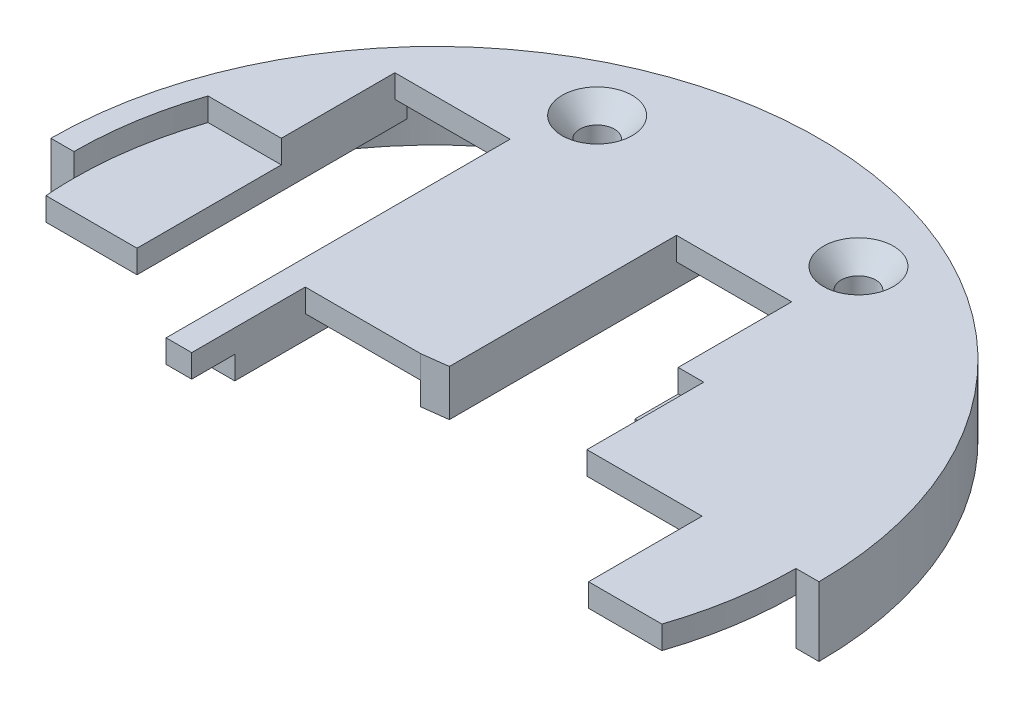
SolidWorks part; units mm, degrees
other "<a2>-<<a_base>-<Holes Pattern>>"
ref_plane "Front Plane" through (0, 0, 0) normal (0, 0, 1) x (1, 0, 0)
ref_plane "Top Plane" through (0, 0, 0) normal (0, 1, 0) x (1, 0, 0)
ref_plane "Right Plane" through (0, 0, 0) normal (1, 0, 0) x (0, 0, -1)
inserted part "a2"
sketch "Sketch3" plane through (0, 1.5, 0) normal (0, 1, 0) x (1, 0, 0)
  line L0 (-35, 14.9985) -> (-20, 14.9985) construction
  line L1 (-35, 0.2128) -> (-35, 29.7843) construction
  line L2 (-20, 29.7843) -> (-20, 0.2128) construction
  line L3 (-16.6667, -14.9985) -> (-1.6667, -14.9985) construction
  line L4 (-16.6667, -29.7843) -> (-16.6667, -0.2128) construction
  line L5 (-1.6667, -0.2128) -> (-1.6667, -29.7843) construction
  line L6 (1.6667, 14.9985) -> (16.6667, 14.9985) construction
  line L7 (1.6667, 0.2128) -> (1.6667, 29.7843) construction
  line L8 (16.6667, 29.7843) -> (16.6667, 0.2128) construction
  line L9 (20, -14.9985) -> (35, -14.9985) construction
  line L10 (20, -29.7843) -> (20, -0.2128) construction
  line L11 (35, -0.2128) -> (35, -29.7843) construction
  line L12 (-35, 14.9985) -> (-47.6974, 14.9985) construction
  line L13 (35, -14.9985) -> (47.6974, -14.9985) construction
  line L14 (-20, 14.9985) -> (-20, -14.9985) construction
  line L15 (-20, -14.9985) -> (-16.6667, -14.9985) construction
  line L16 (20, -14.9985) -> (20, -0.2128) construction
  line L17 (20, -0.2128) -> (20, 14.9985) construction
  line L18 (20, 14.9985) -> (16.6667, 14.9985) construction
  line L19 (1.6667, 14.9985) -> (1.6667, 0.2128) construction
  line L20 (1.6667, 0.2128) -> (0, 0) construction
  line L21 (0, 0) -> (-1.6667, -0.2128) construction
  line L22 (-1.6667, -0.2128) -> (-1.6667, -14.9985) construction
  line L23 (-47.6974, 14.9985) -> (-20, 14.9985)
  line L24 (-20, 14.9985) -> (-20, -14.9985)
  line L25 (-20, -14.9985) -> (-1.6667, -14.9985)
  line L26 (-1.6667, -14.9985) -> (-1.6667, -0.2128)
  line L27 (-1.6667, -0.2128) -> (1.6667, 0.2128)
  line L28 (1.6667, 0.2128) -> (1.6667, 14.9985)
  line L29 (1.6667, 14.9985) -> (20, 14.9985)
  line L30 (20, 14.9985) -> (20, -14.9985)
  line L31 (20, -14.9985) -> (47.6974, -14.9985)
  circle A0 centre (0, 0) radius 50 construction
  arc A1 (-47.6974, 14.9985) -> (47.6974, -14.9985) centre (0, 0) ccw
extrude "Cut-Extrude2" cut sketch "Sketch3" against normal through all contours L31 L30 L29 L27 L25 L24 L23 M1 M2 M3 M5 M6 M9 M10 M11 M14 M15 M21 M20 M17 | M17 | M20
sketch "Sketch4" plane through (0, -1.5, 0) normal (0, -1, 0) x (1, 0, 0)
  line L0 (-38, -14.9985) -> (-38, -27.6586) construction
  line L1 (-44.5426, -14.9985) -> (-38, -14.9985) construction
  line L2 (-38, -14.9985) -> (-38, -27.6586)
  line L3 (-44.5426, -14.9985) -> (-38, -14.9985)
  line L18 (20, -42.5323) -> (20, -40.7843) construction
  line L19 (20, -35.4718) -> (20, -14.9985) construction
  line L20 (20, -42.5323) -> (20, -40.7843)
  line L21 (20, -35.4718) -> (20, -14.9985)
  line L22 (35, -6.7872) -> (35, -31.3688) construction
  line L23 (20, -6.7872) -> (35, -6.7872) construction
  line L24 (35, -6.7872) -> (35, -31.3688)
  line L25 (20, -6.7872) -> (35, -6.7872)
  line L26 (20, -6.7872) -> (20, -14.9985) construction
  line L27 (20, -6.7872) -> (20, -14.9985)
  line L28 (38, -27.6586) -> (38, 14.9985) construction
  line L29 (38, 14.9985) -> (44.5426, 14.9985) construction
  line L30 (38, -27.6586) -> (38, 14.9985)
  line L31 (38, 14.9985) -> (44.5426, 14.9985)
  arc A0 (-44.5426, -14.9985) -> (-38, -27.6586) centre (0, 0) ccw construction
  arc A1 (-44.5426, -14.9985) -> (-38, -27.6586) centre (0, 0) ccw
  arc A10 (20, -40.7843) -> (20, -35.4718) centre (17.0093, -38.128) ccw construction
  arc A11 (20, -40.7843) -> (20, -35.4718) centre (17.0093, -38.128) ccw
  arc A12 (20, -42.5323) -> (35, -31.3688) centre (0, 0) ccw construction
  arc A13 (20, -42.5323) -> (35, -31.3688) centre (0, 0) ccw
  arc A14 (38, -27.6586) -> (44.5426, 14.9985) centre (0, 0) ccw construction
  arc A15 (38, -27.6586) -> (44.5426, 14.9985) centre (0, 0) ccw
extrude "Boss-Extrude2" add sketch "Sketch4" along normal up to surface (3 mm away)
sketch "Sketch5" plane through (0, -4.5, 0) normal (0, -1, 0) x (1, 0, 0)
  line L0 (-35, -14.9985) -> (-35, 3.7872)
  line L2 (-35, -29.7843) -> (-20, -29.7843) construction
  line L3 (1.6667, -0.2128) -> (-1.6667, 0.2128) construction
  line L4 (-44.5426, -14.9985) -> (-35, -14.9985)
  line L5 (-35, 3.7872) -> (-46.8472, 3.7872)
  line L7 (16.6667, -14.9985) -> (20, -14.9985)
  line L8 (16.6667, -14.9985) -> (16.6667, -9.3929)
  line L9 (16.6667, -9.3929) -> (20, -9.3929)
  line L10 (20, -14.9985) -> (20, -9.3929)
  line L11 (20, -14.9985) -> (20, -3.7872) construction
  arc A0 (-44.5426, -14.9985) -> (-46.8472, 3.7872) centre (0, 0) cw
  dimension "D1" = 33.5715
extrude "Boss-Extrude3" add sketch "Sketch5" against normal up to surface (3 mm away)
sketch "Sketch6" plane through (0, -4.5, 0) normal (0, -1, 0) x (1, 0, 0)
  line L0 (35, 14.9985) -> (44.5426, 14.9985)
  line L1 (35, 14.9985) -> (35, -3.7872)
  line L2 (35, 14.9985) -> (35, -3.7872) construction
  line L3 (35, -3.7872) -> (46.8472, -3.7872)
  line L6 (-20, 14.9985) -> (-20, -33.7843) construction
  line L7 (-20, 9.3929) -> (-16.6667, 9.3929)
  line L8 (-20, 9.3929) -> (-20, 14.9985)
  line L9 (-20, 14.9985) -> (-16.6667, 14.9985)
  line L10 (-16.6667, 9.3929) -> (-16.6667, 14.9985)
  line L11 (16.6667, -9.3929) -> (16.6667, -14.9985) construction
  arc A0 (-32.6745, -33.7843) -> (-16.6667, -43.9457) centre (0, 0) ccw construction
  arc A1 (46.8472, -3.7872) -> (44.5426, 14.9985) centre (0, 0) ccw
extrude "Cut-Extrude3" cut sketch "Sketch6" against normal up to surface (3 mm away)
sketch "Sketch7" plane through (0, -7.5, 0) normal (0, -1, 0) x (1, 0, 0)
  line L0 (0, 0) -> (47, 0) construction
  line L2 (47, 0) -> (50, 0)
  line L3 (44.5426, 14.9985) -> (47.6974, 14.9985)
  arc A0 (-44.5426, -14.9985) -> (44.5426, 14.9985) centre (0, 0) ccw construction
  arc A2 (-47.6974, -14.9985) -> (47.6974, 14.9985) centre (0, 0) ccw construction
  arc A3 (47, 0) -> (44.5426, 14.9985) centre (0, 0) ccw
  arc A4 (50, 0) -> (47.6974, 14.9985) centre (0, 0) ccw
extrude "Cut-Extrude4" cut sketch "Sketch7" against normal through all
sketch "Sketch8" plane through (0, -7.5, 0) normal (0, -1, 0) x (1, 0, 0)
  line L0 (0, 0) -> (-57.8758, 0) construction
  line L1 (-50, 0) -> (-47, 0)
  line L2 (-47.6974, -14.9985) -> (-44.5426, -14.9985)
  arc A0 (-47.6974, -14.9985) -> (-50, 0) centre (0, 0) cw
  arc A1 (-44.5426, -14.9985) -> (-47, 0) centre (0, 0) cw
  arc A3 (-47.6974, -14.9985) -> (50, 0) centre (0, 0) ccw construction
extrude "Boss-Extrude4" add sketch "Sketch8" against normal up to surface (9 mm away)
